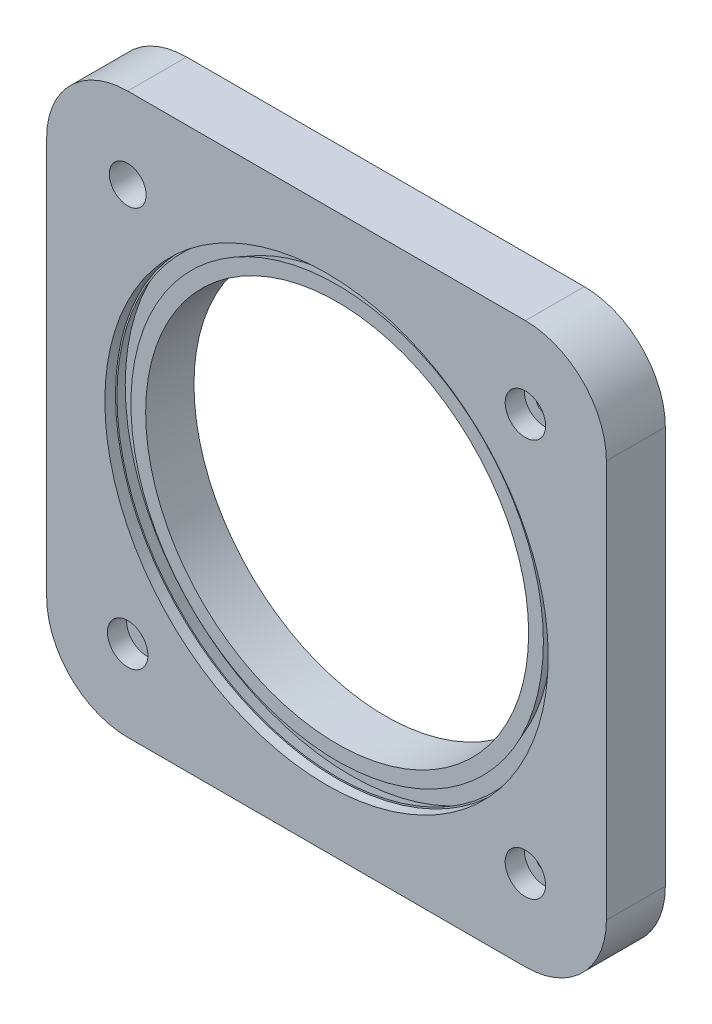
SolidWorks part; units mm, degrees
ref_plane "Plane1" through (0, 0, 0) normal (0, 0, 1) x (1, 0, 0)
ref_plane "Plane2" through (0, 0, 0) normal (0, 1, 0) x (1, 0, 0)
ref_plane "Plane3" through (0, 0, 0) normal (1, 0, 0) x (0, 0, -1)
sketch "Sketch1" plane through (0, 0, 0) normal (0, 0, 1) x (1, 0, 0)
  line L0 (120.65, 85.725) -> (120.65, -85.725)
  line L1 (-120.65, 85.725) -> (-120.65, -85.725)
  line L2 (85.725, -120.65) -> (-85.725, -120.65)
  line L3 (85.725, 120.65) -> (-85.725, 120.65)
  line L4 (0, 0) -> (-203.2125, 0) construction
  line L5 (0, 0) -> (0, 144.6855) construction
  arc A0 (-120.65, 85.725) -> (-85.725, 120.65) centre (-85.725, 85.725) cw
  arc A1 (-85.725, -120.65) -> (-120.65, -85.725) centre (-85.725, -85.725) cw
  arc A2 (85.725, -120.65) -> (120.65, -85.725) centre (85.725, -85.725) ccw
  arc A3 (85.725, 120.65) -> (120.65, 85.725) centre (85.725, 85.725) cw
  circle A4 centre (0, 0) radius 82.55
  circle A5 centre (-85.4964, -85.4964) radius 3.3655
  circle A7 centre (85.4964, 85.4964) radius 3.3655
  circle A8 centre (85.4964, -85.4964) radius 3.3655
  circle A9 centre (-85.725, 85.725) radius 7.9375
  point P5 (-120.65, 120.65)
  point P14 (120.65, 120.65)
  dimension "D5" = 34.925
  dimension "D6" = 165.1
  dimension "D7" = 6.731
  dimension "D9" = 85.4964
  dimension "D10" = 15.875
  dimension "D1" = 120.65
  dimension "D2" = 241.3
  dimension "D3" = 120.65
  dimension "D4" = 241.3
  dimension "D8" = 85.4964
extrude "Base-Extrude" add sketch "Sketch1" along normal blind 25.4
sketch "Sketch2" plane through (0, 0, 25.4) normal (0, 0, 1) x (1, 0, 0)
  circle A0 centre (0, 0) radius 95.5675
  dimension "D1" = 191.135
sketch "Sketch3" plane through (0, 0, 25.4) normal (0, 0, 1) x (1, 0, 0)
  circle A0 centre (0, 0) radius 94.9325
  dimension "D1" = 189.865
sketch "Sketch4" plane through (0, 0, 0) normal (1, 0, 0) x (0, 0, -1)
  line L0 (-20.828, 94.9325) -> (-20.828, 77.5467) construction
  line L6 (-25.4, 91.9226) -> (-18.4374, 91.9226) construction
  line L7 (-25.4, 85.725) -> (-25.4, -85.725) construction
  line L8 (-15.0876, 97.1016) -> (-20.828, 94.9325)
  line L9 (-15.0876, 97.1016) -> (-15.0876, 86.7436)
  line L10 (-15.0876, 86.7436) -> (-20.828, 88.9127)
  line L11 (-20.828, 88.9127) -> (-20.828, 94.9325)
  point P11 (-19.6596, 91.9226)
  point P19 (-15.0876, 91.9226)
  dimension "D1" = 4.572
sweep "Cut-Sweep1" cut profiles "Sketch4" path "Sketch3"
sketch "Sketch5" plane through (0, 0, 25.4) normal (0, 0, 1) x (1, 0, 0)
  circle A0 centre (0, 0) radius 95.5675
  dimension "D1" = 191.135
extrude "Cut-Extrude2" cut sketch "Sketch5" against normal blind 4.572
sketch "Sketch6" plane through (0, 0, 0) normal (0, 0, -1) x (-1, 0, 0)
  line L0 (0, 0) -> (32.9785, 0) construction
  line L1 (0, 0) -> (0, 48.0821) construction
  circle A0 centre (85.725, -85.725) radius 6.477
  circle A1 centre (-85.725, -85.725) radius 6.477
  circle A2 centre (-85.725, 85.725) radius 6.477
  dimension "D1" = 12.954
extrude "Cut-Extrude3" cut sketch "Sketch6" against normal blind 2.54
sketch "Sketch7" plane through (0, 0, 25.4) normal (0, 0, 1) x (1, 0, 0)
  line L0 (0, 0) -> (0, 21.2005) construction
  line L1 (0, 0) -> (27.713, 0) construction
  circle A0 centre (85.725, -85.725) radius 8.7122
  circle A1 centre (85.725, 85.725) radius 8.7122
  circle A2 centre (-85.725, -85.725) radius 8.7122
  dimension "D1" = 17.4244
extrude "Cut-Extrude4" cut sketch "Sketch7" against normal blind 8.255
sketch "Sketch8" plane through (0, 0, 0) normal (0, 0, -1) x (-1, 0, 0)
  circle A0 centre (0, 0) radius 95.5675
  circle A1 centre (0, 0) radius 86.6267
  dimension "D1" = 191.135
  dimension "D2" = 173.2534
extrude "Cut-Extrude5" cut sketch "Sketch8" against normal blind 5.2324
